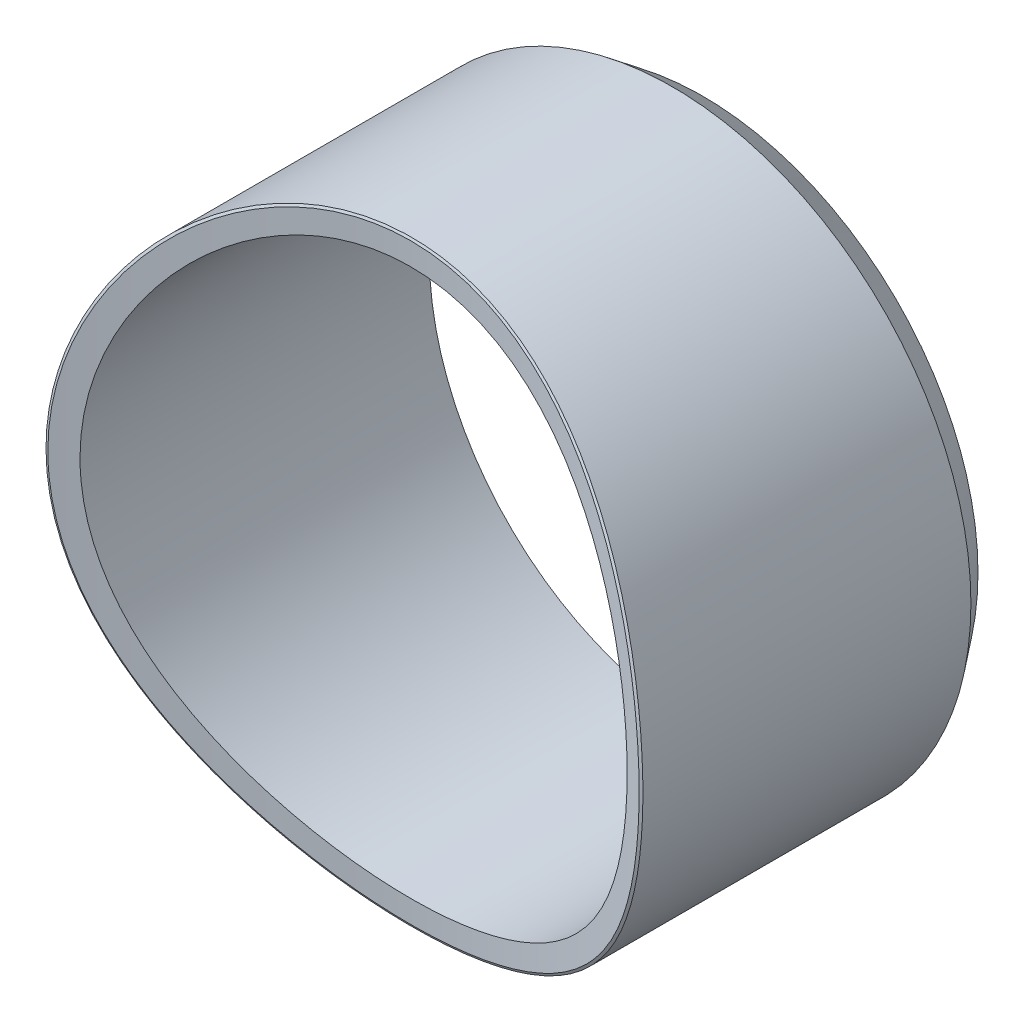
SolidWorks part; units mm, degrees
ref_plane "Front" through (0, 0, 0) normal (0, 0, 1) x (1, 0, 0)
ref_plane "Top" through (0, 0, 0) normal (0, 1, 0) x (1, 0, 0)
ref_plane "Right" through (0, 0, 0) normal (1, 0, 0) x (0, 0, -1)
sketch "Sketch1" plane through (0, 0, 0) normal (0, 0, 1) x (1, 0, 0)
  circle A0 centre (0, 0) radius 304.8
  circle A1 centre (0, 0) radius 279.4
  dimension "D1" = 609.6
  dimension "D2" = 25.4
extrude "Extrude1" add sketch "Sketch1" along normal blind 635
sketch "Sketch2" plane through (0, 0, 0) normal (0, 1, 0) x (1, 0, 0)
  line L0 (0, 116.3459) -> (0, -996.95) construction
  circle A0 centre (0, -996.95) radius 698.5
  point P0 (0, -298.45)
  dimension "D1" = 298.45
  dimension "D2" = 698.5
extrude "Cut-Extrude1" cut sketch "Sketch2" against normal through all and the other way through all
sketch "Sketch4" plane through (0, 0, 0) normal (1, 0, 0) x (0, 0, -1)
  line L0 (-404.6863, 0) -> (0, 0) construction
  line L1 (-31.0331, -304.8) -> (0, -280.9875)
  line L4 (-298.45, -304.8) -> (0, -304.8) construction
  line L5 (0, -304.8) -> (0, 304.8) construction
  line L6 (0, -280.9875) -> (0, -304.8)
  line L7 (0, -304.8) -> (-31.0331, -304.8)
  dimension "D1" = 1.5875
  dimension "D2" = 37.5
revolve "Cut-Revolve1" cut sketch "Sketch4" angle 360 about L0
chamfer "Chamfer1" distance 3.175 angle 45 1 edges at (302.0903, -40.5525, 367.1534)
